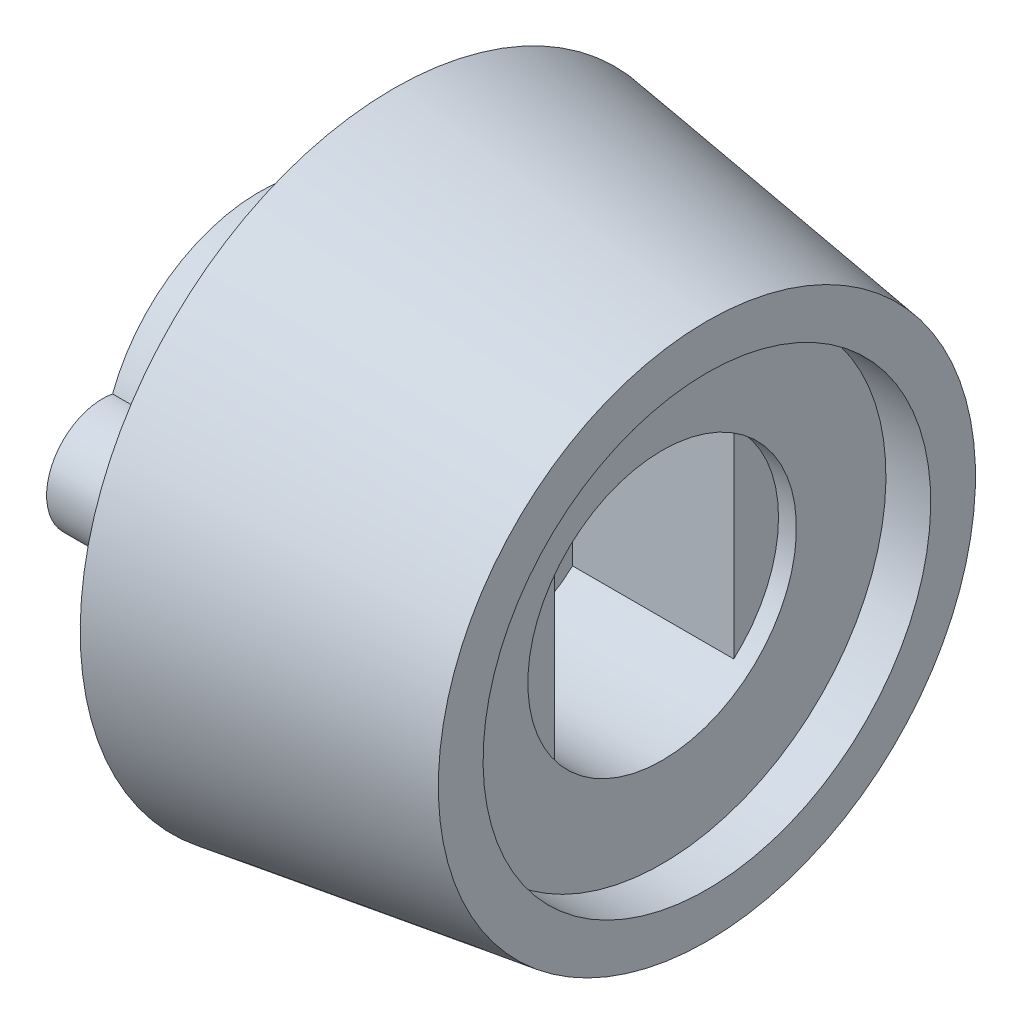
SolidWorks part; units mm, degrees
ref_plane "Plan de face" through (0, 0, 0) normal (0, 0, 1) x (1, 0, 0)
ref_plane "Plan de dessus" through (0, 0, 0) normal (0, 1, 0) x (1, 0, 0)
ref_plane "Plan de droite" through (0, 0, 0) normal (1, 0, 0) x (0, 0, -1)
sketch "Esquisse1" plane through (0, 0, 0) normal (0, 0, 1) x (1, 0, 0)
  line L0 (-18.0928, 0) -> (-18.0928, 7)
  line L1 (-18.0928, 7) -> (-11.0928, 6)
  line L2 (-11.0928, 6) -> (-11.0928, 0)
  line L3 (-11.0928, 0) -> (-18.0928, 0)
  dimension "D1" = 7
  dimension "D2" = 7
  dimension "D3" = 6
revolve "Révolution1" add sketch "Esquisse1" angle 360 about L3
sketch "Esquisse2" plane through (-18.0928, 0, 0) normal (-1, 0, 0) x (0, 0, 1)
  circle A0 centre (0, 0) radius 3.5
  dimension "D1" = 7
extrude "Extrusion1" add sketch "Esquisse2" along normal blind 3
sketch "Esquisse5" plane through (-18.0928, 0, 0) normal (-1, 0, 0) x (0, 0, 1)
  circle A0 centre (3.5, 0) radius 1.2503
  dimension "D1" = 2.5006
extrude "Extrusion2" add sketch "Esquisse5" along normal up to surface (3 mm away)
sketch "Esquisse6" plane through (-11.0928, 0, 0) normal (1, 0, 0) x (0, 0, -1)
  circle A0 centre (0, 0) radius 5
  dimension "D1" = 10
extrude "Enlèv. mat.-Extru.5" cut sketch "Esquisse6" against normal blind 1
sketch "Esquisse7" plane through (-21.0928, 0, 0) normal (-1, 0, 0) x (0, 0, 1)
  circle A0 centre (0, 0) radius 2
  dimension "D1" = 4
extrude "Enlèv. mat.-Extru.6" cut sketch "Esquisse7" against normal through all
sketch "Esquisse8" plane through (-12.0928, 0, 0) normal (1, 0, 0) x (0, 0, -1)
  circle A0 centre (0, 0) radius 3
  dimension "D1" = 6
extrude "Enlèv. mat.-Extru.7" cut sketch "Esquisse8" against normal blind 4
sketch "Esquisse9" plane through (-16.0928, 0, 0) normal (1, 0, 0) x (0, 0, -1)
  line L0 (-2, -2.2361) -> (-2, 2.2361)
  line L1 (2, 2.2361) -> (2, -2.2361)
  circle A0 centre (0, 0) radius 3 construction
  arc A1 (2, -2.2361) -> (2, 2.2361) centre (0, 0) ccw
  arc A2 (-2, 2.2361) -> (-2, -2.2361) centre (0, 0) ccw
  dimension "D1" = 4
  dimension "D2" = 2
extrude "Extrusion4" add sketch "Esquisse9" along normal blind 3.6
